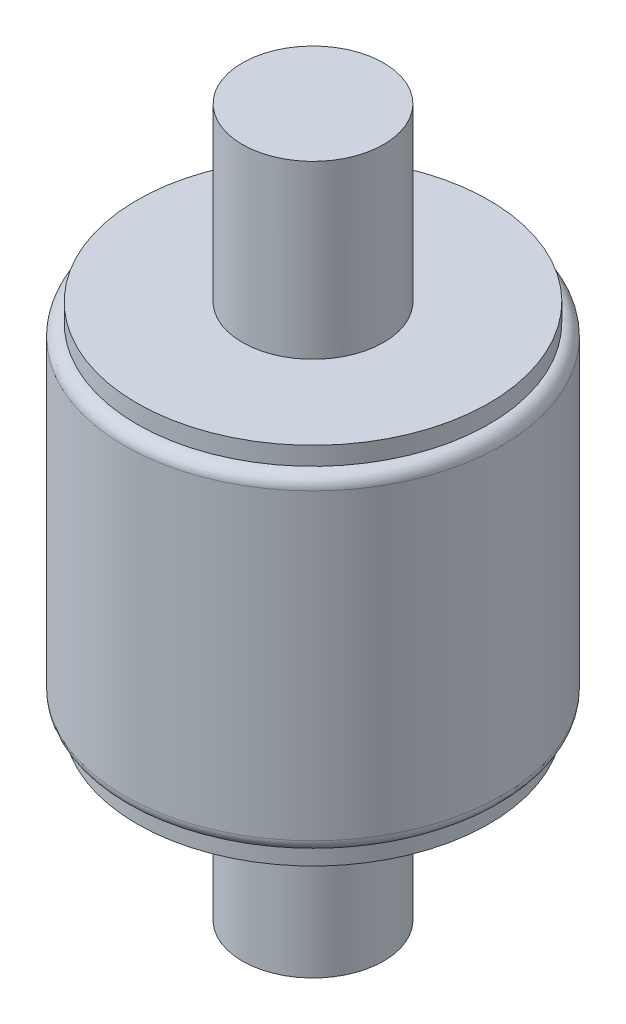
SolidWorks part; units mm, degrees
ref_plane "Plan de face" through (0, 0, 0) normal (0, 0, 1) x (1, 0, 0)
ref_plane "Plan de dessus" through (0, 0, 0) normal (0, 1, 0) x (1, 0, 0)
ref_plane "Plan de droite" through (0, 0, 0) normal (1, 0, 0) x (0, 0, -1)
sketch "Esquisse1" plane through (0, 0, 0) normal (0, 0, 1) x (1, 0, 0)
  line L0 (-47.6354, 43.1558) -> (-47.6354, 42.5708)
  line L1 (-53.2854, 43.1558) -> (-47.6354, 43.1558)
  line L2 (-53.2854, 43.1558) -> (-53.2854, 31.4558)
  line L3 (-53.2854, 31.4558) -> (-47.6354, 31.4558)
  line L4 (-47.2354, 42.1708) -> (-47.2354, 32.4408)
  line L6 (-47.6354, 31.4558) -> (-47.6354, 32.0408)
  arc A0 (-47.2354, 42.1708) -> (-47.6354, 42.5708) centre (-47.6354, 42.1708) ccw
  arc A1 (-47.2354, 32.4408) -> (-47.6354, 32.0408) centre (-47.6354, 32.4408) cw
revolve "Révolution1" add sketch "Esquisse1" angle 360 about L2
sketch "Esquisse2" plane through (0, 43.1558, 0) normal (0, 1, 0) x (1, 0, 0)
  circle A0 centre (-53.2854, 0) radius 2.269
  dimension "D1" = 4.538
extrude "Boss.-Extru.1" add sketch "Esquisse2" along normal blind 5.505 and the other way blind 17.205
